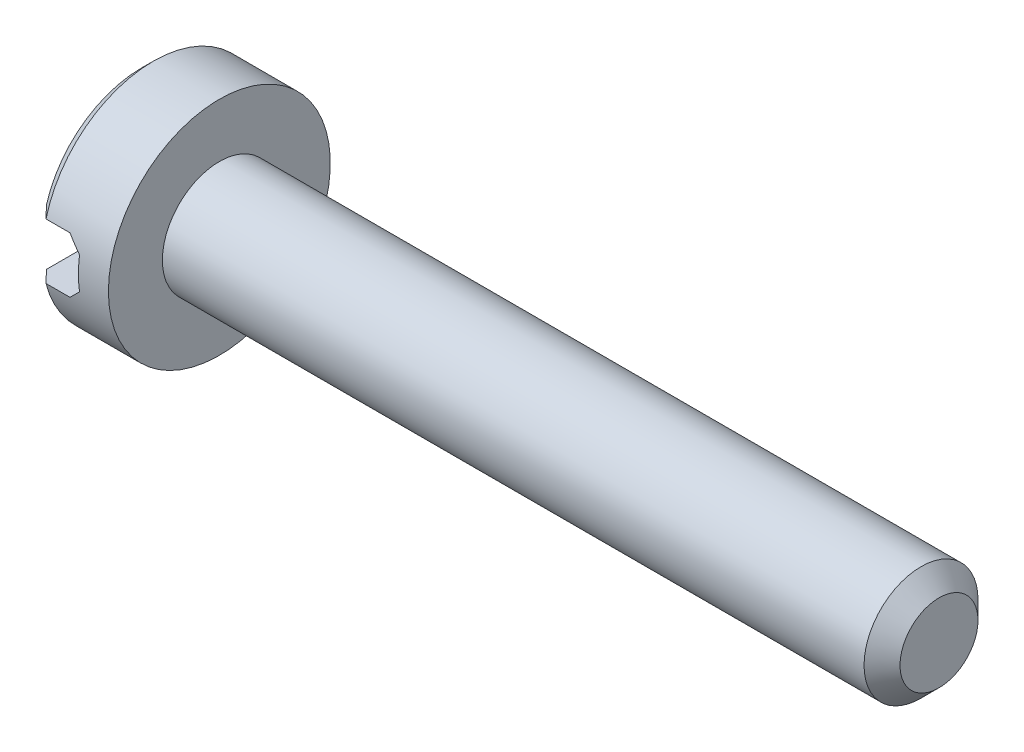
SolidWorks part; units mm, degrees
ref_plane "Face" through (0, 0, 0) normal (0, 0, 1) x (1, 0, 0)
ref_plane "Dessus" through (0, 0, 0) normal (0, 1, 0) x (1, 0, 0)
ref_plane "Droite" through (0, 0, 0) normal (1, 0, 0) x (0, 0, -1)
sketch "Esquisse1" plane through (0, 0, 0) normal (0, 0, 1) x (1, 0, 0)
  line L0 (0, 0) -> (0, 1.65)
  line L1 (0.2, 1.85) -> (1.3, 1.85)
  line L2 (1.3, 1.85) -> (1.3, 0)
  line L5 (0, 0) -> (7.6423, 0) construction
  line L7 (0, 1.65) -> (0.2, 1.85)
  line L8 (0, 0) -> (1.3, 0)
  point P1 (0, 1.85)
  dimension "D1" = 1.85
  dimension "D3" = 1.3
revolve "Révolution1" add sketch "Esquisse1" angle 360 about L5
sketch "Esquisse2" plane through (0, 0, 0) normal (0, 0, 1) x (1, 0, 0)
  line L0 (0, 1.65) -> (0, -1.65) construction
  line L1 (0, 0.4655) -> (0.6, 0.4655)
  line L2 (0, 0.4655) -> (0, -0.4655)
  line L3 (0, -0.4655) -> (0.6, -0.4655)
  line L4 (0.8, 0.2655) -> (0.8, -0.2655)
  line L5 (0.6, 0.4655) -> (0.8, 0.2655)
  line L6 (0.6, -0.4655) -> (0.8, -0.2655)
  point P1 (0.8, -0.4655)
  point P3 (0.8, 0.4655)
extrude "Enlèv. mat.-Extru.1" cut sketch "Esquisse2" against normal mid plane 10
sketch "Esquisse3" plane through (1.3, 0, 0) normal (1, 0, 0) x (0, 0, -1)
  circle A0 centre (0, 0) radius 0.95
extrude "Extrusion1" add sketch "Esquisse3" along normal blind 12
chamfer "Chanfrein1" distance 0.3 angle 45 1 edges at (13.3, 0, -0.95)
